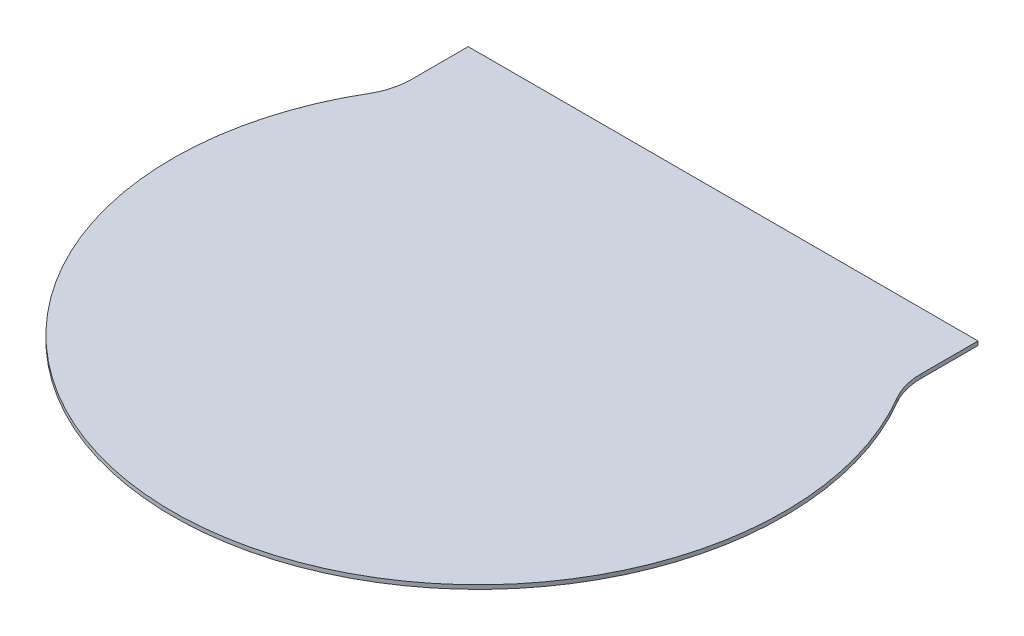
SolidWorks part; units mm, degrees
ref_plane "Front Plane" through (0, 0, 0) normal (0, 0, 1) x (1, 0, 0)
ref_plane "Top Plane" through (0, 0, 0) normal (0, 1, 0) x (1, 0, 0)
ref_plane "Right Plane" through (0, 0, 0) normal (1, 0, 0) x (0, 0, -1)
sketch "Sketch1" plane through (0, 0, 0) normal (0, 1, 0) x (1, 0, 0)
  line L0 (3.175, 3.048) -> (-3.175, 3.048)
  line L1 (-3.175, 2.3383) -> (-3.175, 3.048)
  line L2 (3.175, 2.3383) -> (3.175, 3.048)
  arc A0 (-3.2866, 1.9272) -> (3.2866, 1.9272) centre (0, 0) ccw
  arc A1 (-3.2866, 1.9272) -> (-3.175, 2.3383) centre (-3.9878, 2.3383) ccw
  arc A2 (-3.2866, 1.9272) -> (-3.175, 2.3383) centre (-3.9878, 2.3383) ccw
  arc A3 (3.175, 2.3383) -> (3.2866, 1.9272) centre (3.9878, 2.3383) ccw
extrude "Extrude1" add sketch "Sketch1" along normal blind 0.05 contours A3 L2 L0 L1 A1 A0
